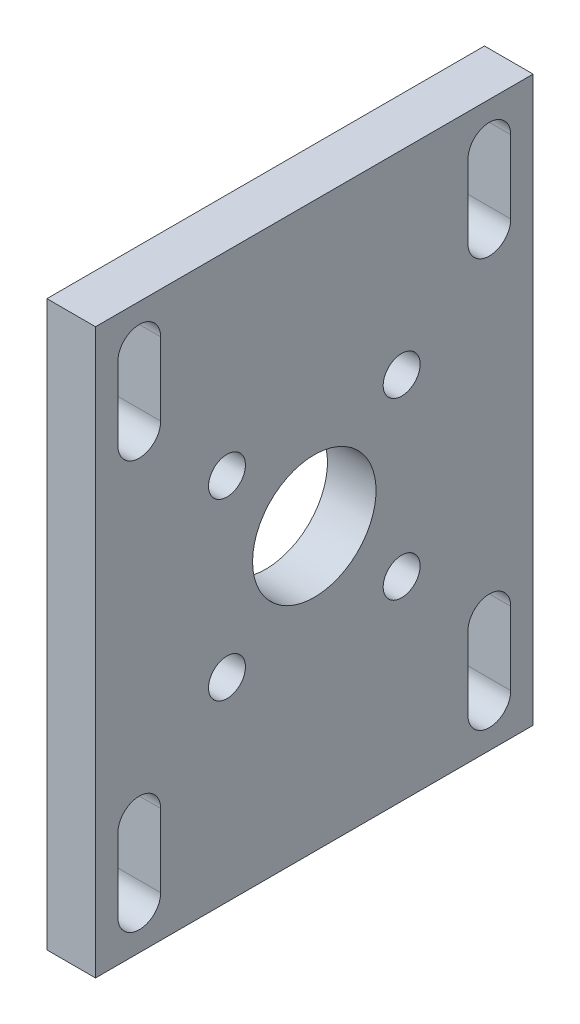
SolidWorks part; units mm, degrees
ref_plane "Front Plane" through (0, 0, 0) normal (0, 0, 1) x (1, 0, 0)
ref_plane "Top Plane" through (0, 0, 0) normal (0, 1, 0) x (1, 0, 0)
ref_plane "Right Plane" through (0, 0, 0) normal (1, 0, 0) x (0, 0, -1)
sketch "Sketch1" plane through (0, 0, 0) normal (1, 0, 0) x (0, 0, -1)
  line L1 (-22.5, -29) -> (22.5, -29)
  line L2 (-22.5, -29) -> (-22.5, 29)
  line L3 (-22.5, 29) -> (22.5, 29)
  line L4 (22.5, -29) -> (22.5, 29)
  line L5 (-22.5, -29) -> (22.5, 29) construction
  line L6 (-22.5, 29) -> (22.5, -29) construction
  point P0 (0, 0)
  dimension "D1" = 45
  dimension "D2" = 58
extrude "Boss-Extrude1" add sketch "Sketch1" along normal blind 5
sketch "Sketch2" plane through (0, 0, 0) normal (-1, 0, 0) x (0, 0, 1)
  circle A0 centre (0, 0) radius 6.35
  dimension "D1" = 12.7
extrude "Cut-Extrude1" cut sketch "Sketch2" against normal through all
hole_wizard "CSK for #6 Flat Head Socket Cap Screw1" positions "Sketch6" profile "Sketch5" countersink size "#6" standard "ANSI Inch"
sketch "Sketch6" plane through (0, 0, 0) normal (-1, 0, 0) x (0, 0, 1)
  point P0 (-8.9803, 8.9803)
  point P3 (8.9803, 8.9803)
  point P6 (8.9803, -8.9803)
  point P9 (-8.9803, -8.9803)
sketch "Sketch5" plane through (0, 8.9803, -8.9803) normal (0, 1, 0) x (0, 0, 1)
  line L0 (0, 0) -> (0, 5)
  line L1 (0, 5) -> (1.8986, 5)
  line L2 (1.8986, 5) -> (1.8986, 2.301)
  line L3 (1.8986, 2.301) -> (3.8989, 0)
  line L5 (3.8989, 0) -> (0, 0)
  line L6 (-1.8987, 2.301) -> (-3.8989, 0) construction
  line L11 (0, -6.35) -> (0, 107.95) construction
  dimension "Thru Hole Dia." = 3.7973
  dimension "Thru Hole Depth" = 5
  dimension "Near C'Sink Dia." = 7.7978
  dimension "Near C'Sink Angle" = 82
sketch "Sketch8" plane through (0, 0, 0) normal (-1, 0, 0) x (0, 0, 1)
  line L0 (-18, -24.75) -> (-18, -17.25) construction
  line L1 (-20.2, -24.75) -> (-20.2, -17.25)
  line L2 (-15.8, -24.75) -> (-15.8, -17.25)
  arc A0 (-20.2, -24.75) -> (-15.8, -24.75) centre (-18, -24.75) ccw
  arc A1 (-15.8, -17.25) -> (-20.2, -17.25) centre (-18, -17.25) ccw
  point P2 (-18, -21)
  dimension "D1" = 2.2
  dimension "D2" = 7.5
  dimension "D3" = 18
  dimension "D4" = 21
extrude "Cut-Extrude2" cut sketch "Sketch8" against normal through all
pattern_linear "LPattern1" count 2 spacing 36 along (0, 0, 1) count 2 spacing 42 along (0, 1, 0) of "Cut-Extrude2"
